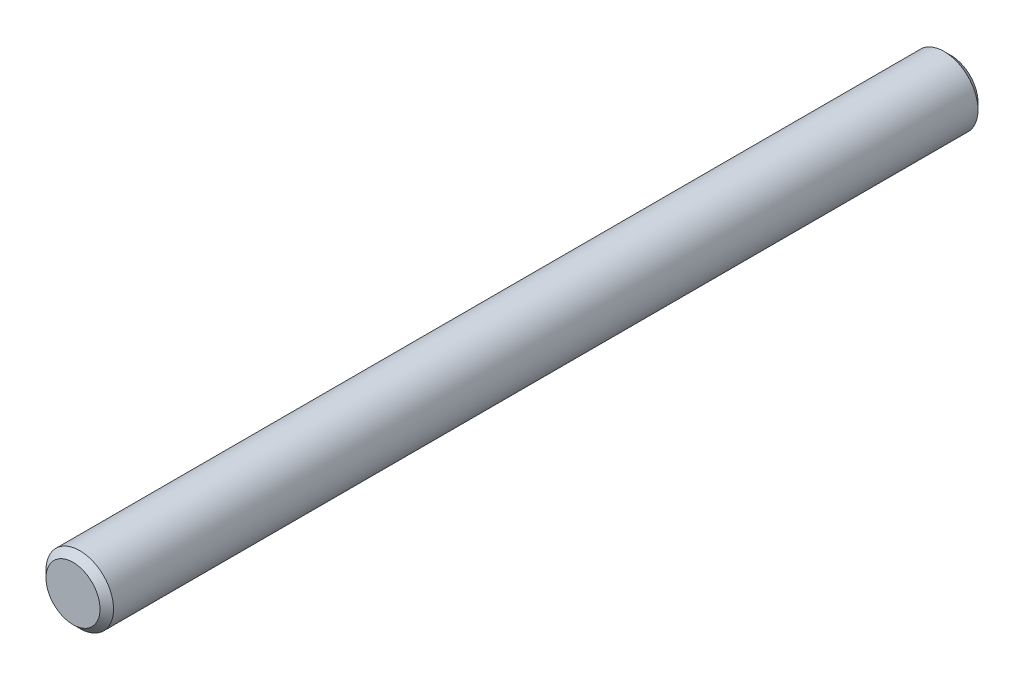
SolidWorks part; units mm, degrees
ref_plane "Plan de face" through (0, 0, 0) normal (0, 0, 1) x (1, 0, 0)
ref_plane "Plan de dessus" through (0, 0, 0) normal (0, 1, 0) x (1, 0, 0)
ref_plane "Plan de droite" through (0, 0, 0) normal (1, 0, 0) x (0, 0, -1)
sketch "Esquisse1" plane through (0, 0, 0) normal (0, 0, 1) x (1, 0, 0)
  circle A0 centre (0, 0) radius 5
  dimension "D1" = 10
extrude "Extrusion1" add sketch "Esquisse1" along normal blind 130
chamfer "Chanfrein1" distance 1 angle 45 2 edges at (5, 0, 0) (5, 0, 130)
